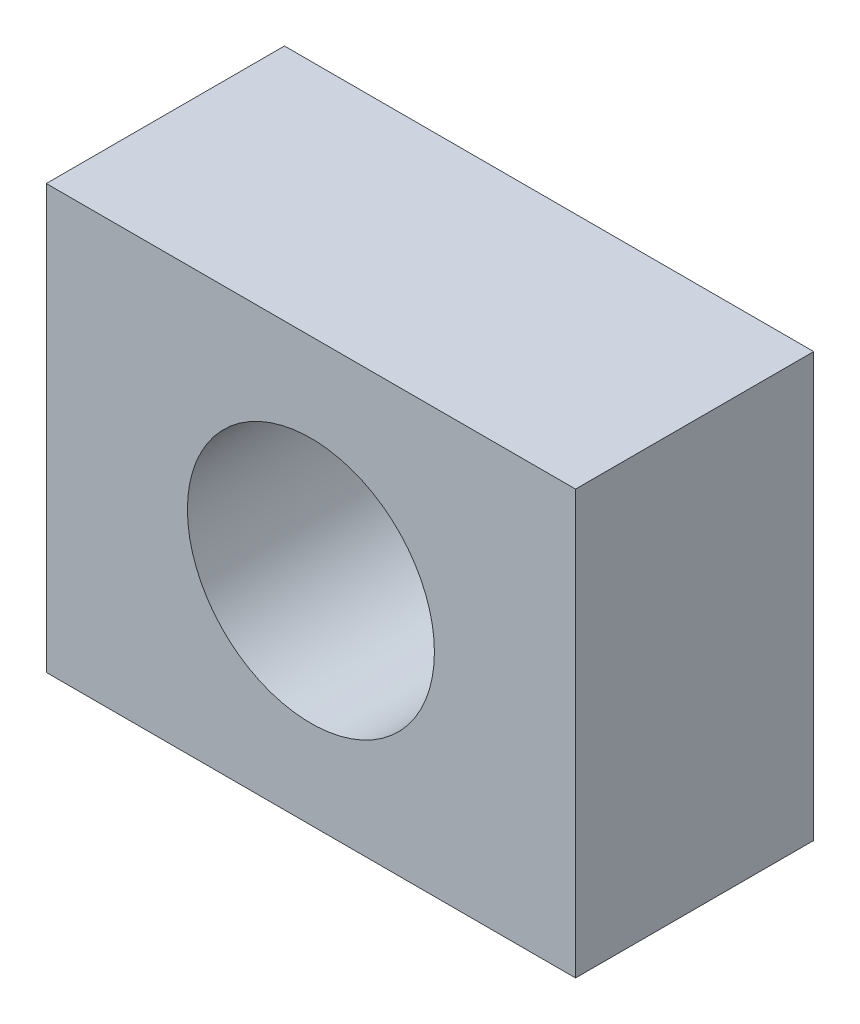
SolidWorks part; units mm, degrees
ref_plane "Plan de face" through (0, 0, 0) normal (0, 0, 1) x (1, 0, 0)
ref_plane "Plan de dessus" through (0, 0, 0) normal (0, 1, 0) x (1, 0, 0)
ref_plane "Plan de droite" through (0, 0, 0) normal (1, 0, 0) x (0, 0, -1)
ref_plane "Plan4" through (0, 0, 13.5) normal (0, 0, 1) x (1, 0, 0)
sketch "Esquisse1" plane through (0, 0, 13.5) normal (0, 0, 1) x (1, 0, 0)
  line L0 (15, 12) -> (-15, 12)
  line L1 (-15, 12) -> (-15, -12)
  line L2 (-15, -12) -> (15, -12)
  line L3 (15, -12) -> (15, 12)
  circle A0 centre (0, 0) radius 7
extrude "Extrusion1" add sketch "Esquisse1" against normal blind 13.5
